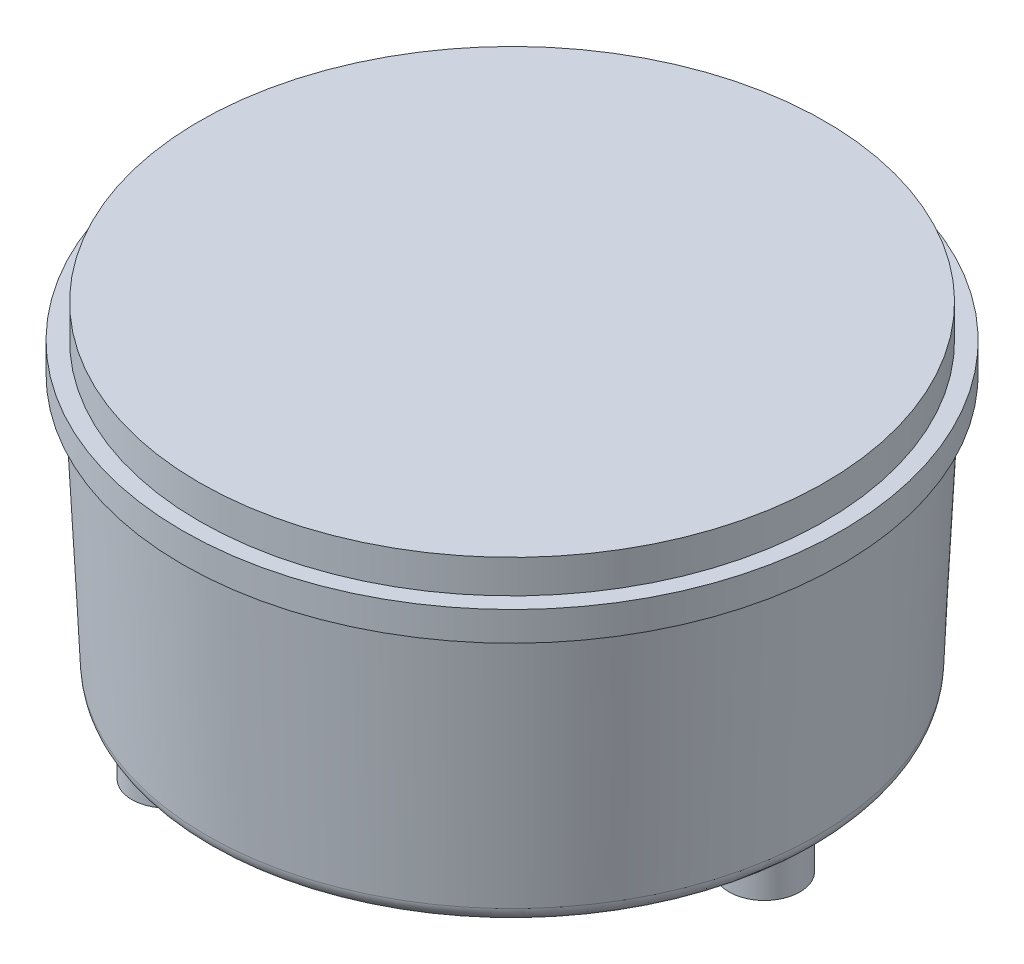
SolidWorks part; units mm, degrees
ref_plane "Plan de face" through (0, 0, 0) normal (0, 0, 1) x (1, 0, 0)
ref_plane "Plan de dessus" through (0, 0, 0) normal (0, 1, 0) x (1, 0, 0)
ref_plane "Plan de droite" through (0, 0, 0) normal (1, 0, 0) x (0, 0, -1)
sketch "Esquisse1" plane through (0, 0, 0) normal (0, 0, 1) x (1, 0, 0)
  line L0 (0, 0) -> (0, 4)
  line L1 (0, 4) -> (-37.5, 4)
  line L2 (-37.5, 4) -> (-37.5, 0)
  line L3 (-37.5, 0) -> (-39.5, 0)
  line L4 (-39.5, 0) -> (-39.5, -3.5)
  line L5 (-39.5, -3.5) -> (-38.9535, -3.5)
  line L6 (-37.9546, -4.4524) -> (-36.5907, -33.0951)
  line L7 (-34.593, -35) -> (0, -35)
  line L8 (0, -35) -> (0, 4)
  line L9 (0, 17.9191) -> (0, -28.5548) construction
  line L10 (29.1972, 70) -> (-29.1972, 70) construction
  line L11 (-37.5, 5.9) -> (-37.5, 0) construction
  arc A0 (-36.5907, -33.0951) -> (-34.593, -35) centre (-34.593, -33) ccw
  arc A1 (-38.9535, -3.5) -> (-37.9546, -4.4524) centre (-38.9535, -4.5) cw
  point P21 (-36.5, -35)
  point P24 (-38, -3.5)
  dimension "D6" = 2
  dimension "D7" = 1
  dimension "D1" = 4
  dimension "D2" = 3.5
  dimension "D3" = 76
  dimension "D4" = 73
  dimension "D5" = 105
revolve "Révolution2" add sketch "Esquisse1" angle 360 about L9
sketch "Esquisse2" plane through (0, -35, 0) normal (0, -1, 0) x (1, 0, 0)
  line L0 (0, 0) -> (-17.9638, 31.1143) construction
  line L1 (0, 0) -> (-23.542, -40.7759) construction
  line L2 (30.25, 0) -> (0, 0) construction
  circle A2 centre (30.25, 0) radius 1.5
  circle A3 centre (30.25, 0) radius 4.25
  circle A8 centre (-15.125, 26.1973) radius 1.5
  circle A9 centre (-15.125, 26.1973) radius 4.25
  circle A10 centre (-15.125, -26.1973) radius 4.25
  circle A11 centre (-15.125, -26.1973) radius 1.5
  dimension "D1" = 8.5
  dimension "D2" = 3
  dimension "D3" = 8.5
  dimension "D4" = 3
  dimension "D5" = 8.5
  dimension "D6" = 3
  dimension "D7" = 30.25
  dimension "D8" = 120
  dimension "D9" = 30.25
  dimension "D10" = 30.25
  dimension "D11" = 120
extrude "Extrusion1" add sketch "Esquisse2" along normal blind 5
fillet "Congé1" radius 1 3 edges at (-15.125, -35, -30.4473) (-15.125, -35, 21.9473) (30.25, -35, -4.25)
